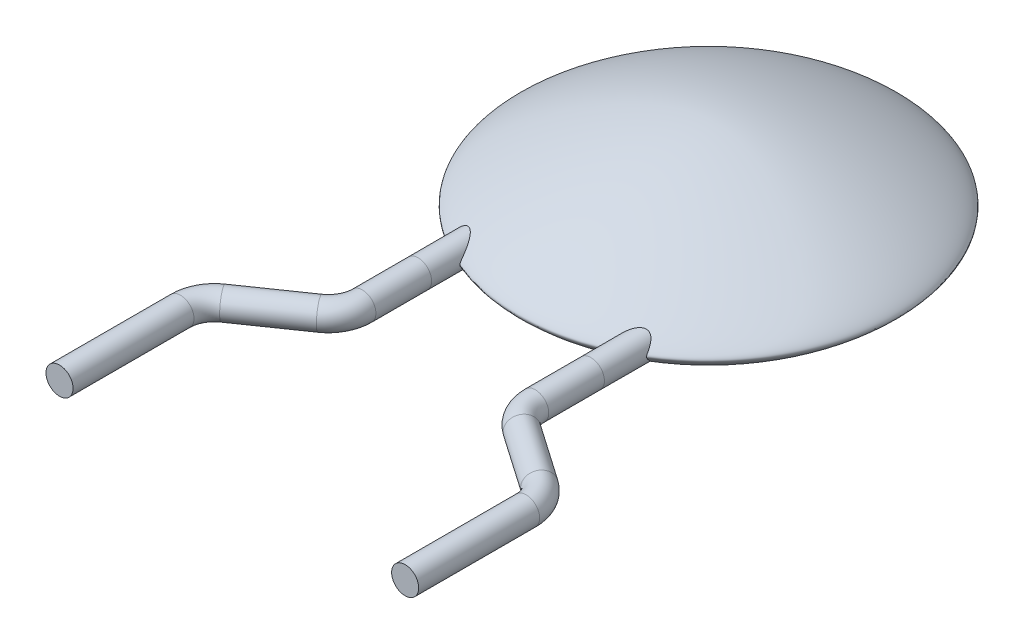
SolidWorks part; units mm, degrees
ref_plane "Plan de face" through (0, 0, 0) normal (0, 0, 1) x (1, 0, 0)
ref_plane "Plan de dessus" through (0, 0, 0) normal (0, 1, 0) x (1, 0, 0)
ref_plane "Plan de droite" through (0, 0, 0) normal (1, 0, 0) x (0, 0, -1)
sketch "Esquisse1" plane through (0, 0, 0) normal (0, 0, 1) x (1, 0, 0)
  line L4 (0, 1.05) -> (0, -1.05)
  spline S0 degree 3 poles (0, 1.05) (-1.1725, 1.05) (-2.8, 0.1619) (-2.8, -0.1619) (-1.2957, -1.05) (0, -1.05) knots 0 0 0 0 0.5 0.5 1 1 1 1
  dimension "D1" = 2.1
revolve "Révolution1" add sketch "Esquisse1" angle 360 about L4
ref_plane "Plan1" through (0, 0, 3) normal (0, 0, 1) x (1, 0, 0)
sketch "Esquisse2" plane through (0, 0, 3) normal (0, 0, 1) x (1, 0, 0)
  circle A0 centre (-1.27, 0) radius 0.2
  circle A1 centre (1.27, 0) radius 0.2
  dimension "D1" = 1.27
  dimension "D2" = 1.27
extrude "Extrusion1" add sketch "Esquisse2" against normal up to next
sketch "Esquisse3" plane through (0, 0, 3) normal (0, 0, 1) x (1, 0, 0)
  line L0 (0, 1.6388) -> (0, -2.0874) construction
  circle A0 centre (-1.27, 0) radius 0.199
sketch "Esquisse4" plane through (0, 0, 0) normal (0, 1, 0) x (1, 0, 0)
  line L0 (0, -1.9103) -> (0, -7.9685) construction
  line L1 (-2.6432, -3) -> (3.2556, -3) construction
  line L2 (-4.3969, -7) -> (4.56, -7) construction
  line L3 (-1.27, -2.5625) -> (-1.27, -3.9248) construction
  line L4 (-2.54, -7.6206) -> (-2.54, -4.3886) construction
  line L5 (-1.27, -3) -> (-1.27, -3.8184)
  line L6 (-1.4851, -4.2293) -> (-2.3249, -4.8115)
  line L7 (-2.54, -5.2224) -> (-2.54, -7)
  arc A0 (-1.27, -3.8184) -> (-1.4851, -4.2293) centre (-1.77, -3.8184) cw
  arc A1 (-2.3249, -4.8115) -> (-2.54, -5.2224) centre (-2.04, -5.2224) ccw
  dimension "D3" = 0.5
  dimension "D1" = 4
  dimension "D2" = 2.54
sweep "Balayage1" add profiles "Esquisse3" path "Esquisse4"
ref_plane "Plan3" through (0, 0, 0) normal (1, 0, 0) x (0, 0, -1)
mirror "Symétrie1" about plane through (0, 0, 0) normal (1, 0, 0) of "Balayage1"
